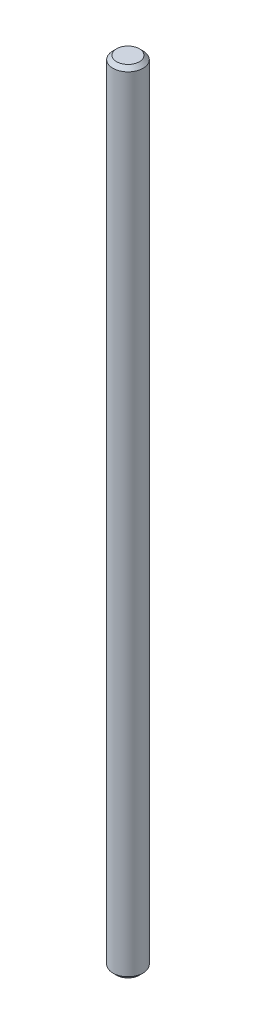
SolidWorks part; units mm, degrees
ref_plane "Face" through (0, 0, 0) normal (0, 0, 1) x (1, 0, 0)
ref_plane "Dessus" through (0, 0, 0) normal (0, 1, 0) x (1, 0, 0)
ref_plane "Droite" through (0, 0, 0) normal (1, 0, 0) x (0, 0, -1)
sketch "Esquisse1" plane through (0, 0, 0) normal (0, 1, 0) x (1, 0, 0)
  circle A0 centre (0, 0) radius 2
extrude "Extrusion1" add sketch "Esquisse1" along normal blind 105
chamfer "Chanfrein1" distance 0.5 angle 45 2 edges at (0, 0, 2) (0, 105, 2)
